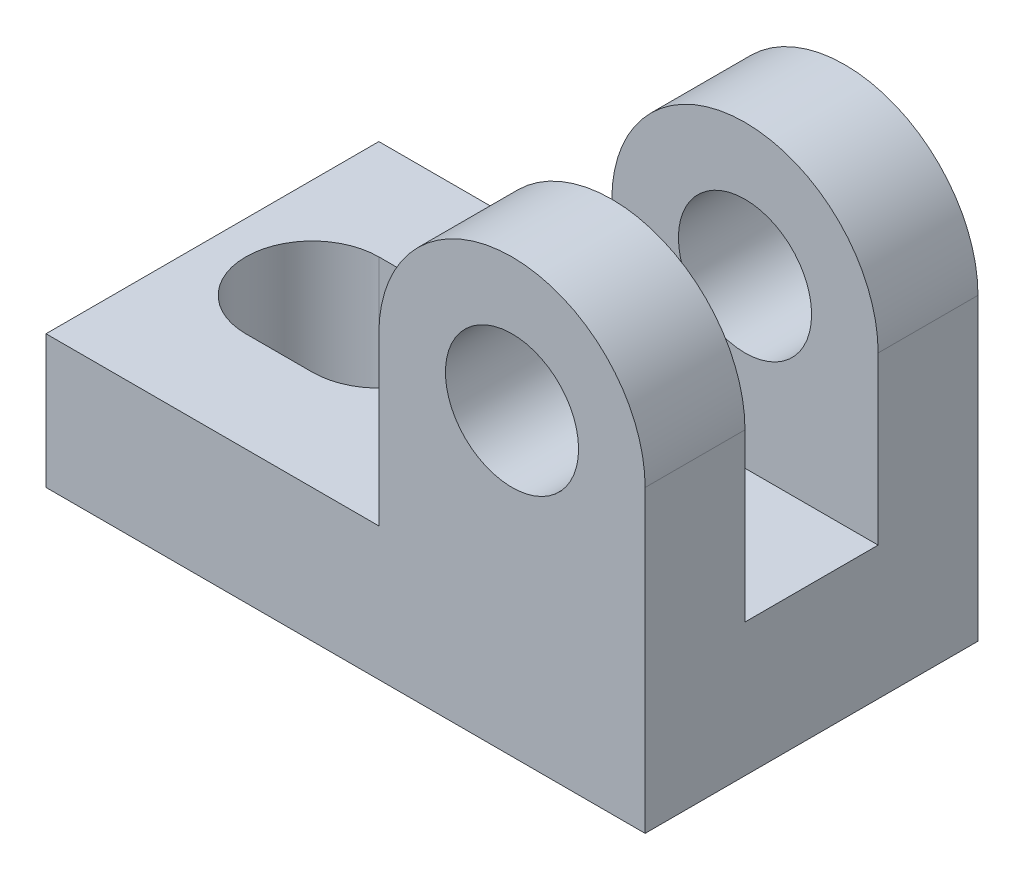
SolidWorks part; units mm, degrees
ref_plane "前视基准面" through (0, 0, 0) normal (0, 0, 1) x (1, 0, 0)
ref_plane "上视基准面" through (0, 0, 0) normal (0, 1, 0) x (1, 0, 0)
ref_plane "右视基准面" through (0, 0, 0) normal (1, 0, 0) x (0, 0, -1)
sketch "草图1" plane through (0, 0, 0) normal (0, 1, 0) x (1, 0, 0)
  line L1 (0, 0) -> (90, 0)
  line L2 (0, 0) -> (0, 50)
  line L3 (0, 50) -> (90, 50)
  line L4 (90, 0) -> (90, 50)
  dimension "D1" = 90
  dimension "D2" = 50
extrude "拉伸1" add sketch "草图1" along normal blind 20
sketch "草图2" plane through (0, 20, 0) normal (0, 1, 0) x (1, 0, 0)
  line L0 (-6.8391, 25) -> (90, 25) construction
  line L1 (90, 0) -> (90, 50) construction
  line L2 (15, 25) -> (25, 25) construction
  line L3 (15, 15) -> (25, 15)
  line L4 (15, 35) -> (25, 35)
  arc A0 (15, 15) -> (15, 35) centre (15, 25) cw
  arc A1 (25, 15) -> (25, 35) centre (25, 25) ccw
  dimension "D3" = 10
  dimension "D4" = 65
  dimension "D1" = 10
  dimension "D2" = 10
extrude "切除-拉伸1" cut sketch "草图2" against normal through all
sketch "草图3" plane through (0, 0, 0) normal (0, 0, 1) x (1, 0, 0)
  line L0 (50, 20) -> (50, 45)
  line L1 (0, 20) -> (90, 20) construction
  line L2 (90, 45) -> (90, 20)
  line L3 (90, 20) -> (50, 20)
  arc A0 (50, 45) -> (90, 45) centre (70, 45) cw
  circle A1 centre (70, 45) radius 10
  dimension "D1" = 20
  dimension "D3" = 20
  dimension "D2" = 25
extrude "拉伸2" add sketch "草图3" against normal up to surface (50 mm away)
sketch "草图4" plane through (90, 0, 0) normal (1, 0, 0) x (0, 0, -1)
  line L0 (15, 20) -> (15, 65)
  line L1 (50, 65) -> (0, 65) construction
  line L2 (15, 65) -> (35, 65)
  line L3 (35, 65) -> (35, 20)
  line L4 (35, 20) -> (15, 20)
extrude "切除-拉伸2" cut sketch "草图4" against normal through all
